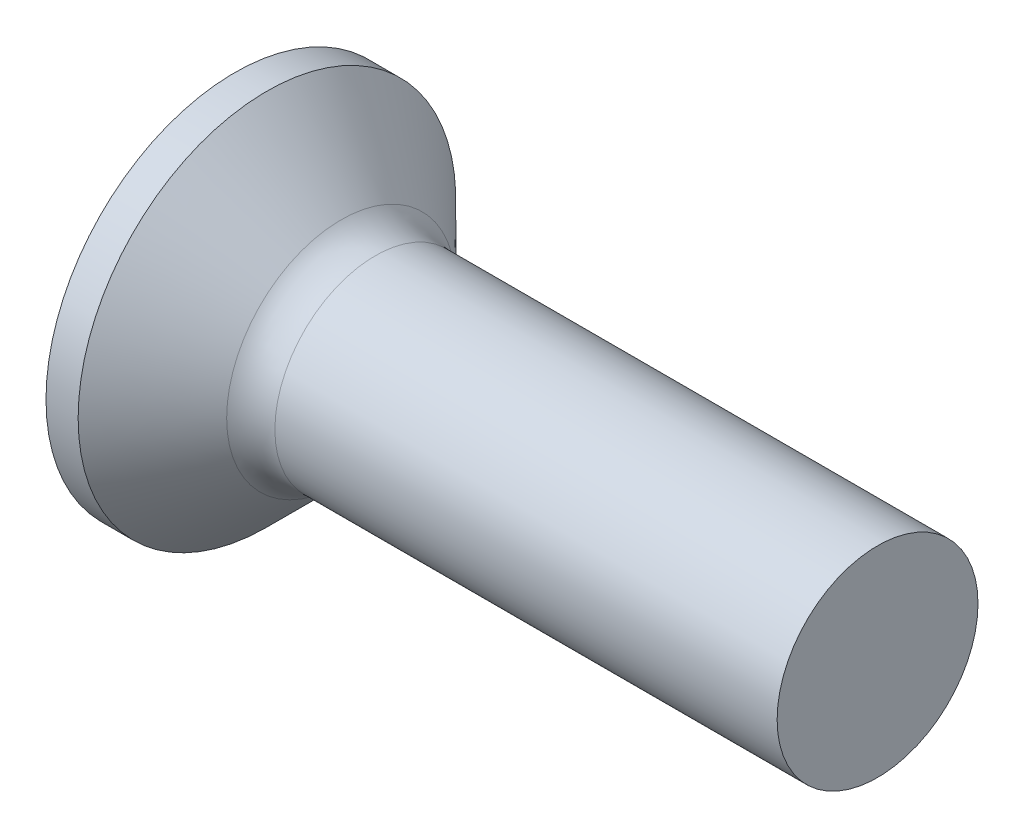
SolidWorks part; units mm, degrees
revolve "Base-Revolve" add sketch "BodySke"
sketch "BodySke" plane through (0, 0, 0) normal (0, 0, 1) x (1, 0, 0)
  line L0 (0, 0) -> (0, 2.35)
  line L1 (0, 2.35) -> (0.4, 2.35)
  line L2 (1.5, 1.25) -> (8, 1.25)
  line L3 (8, 1.25) -> (8, 0)
  line L4 (8, 0) -> (0, 0)
  line L5 (-6.35, 0) -> (82.55, 0) construction
  line L6 (1.5, -1.25) -> (8, -1.25) construction
  line L7 (0.4, -2.35) -> (1.5, -1.25) construction
  line L8 (0.4, 2.35) -> (1.5, 1.25)
  line L9 (0, -2.35) -> (0.4, -2.35) construction
  line L10 (1.95, 2.8375) -> (1.95, -6.6875) construction
  line L11 (0, 6.35) -> (0, -3.175) construction
fillet "Fillet1" radius 0.6 1 edges at (1.5, 0, 1.25)
ref_plane "Plane1" through (0, 0, 0) normal (0, 0, 1) x (1, 0, 0)
ref_plane "Plane2" through (0, 0, 0) normal (0, 1, 0) x (1, 0, 0)
ref_plane "Plane3" through (0, 0, 0) normal (1, 0, 0) x (0, 0, -1)
sketch "Sketch3" plane through (0, 0, 0) normal (-1, 0, 0) x (0, 0, 1)
  line L0 (-0.37, 1.4) -> (0.37, 1.4)
  line L1 (0.37, 1.4) -> (0.37, -1.4)
  line L2 (0.37, -1.4) -> (-0.37, -1.4)
  line L3 (-0.37, -1.4) -> (-0.37, 1.4)
ref_plane "Plane4" through (1.73, 0, 0) normal (-1, 0, 0) x (0, 0, 1)
sketch "Sketch4" plane through (1.73, 0, 0) normal (-1, 0, 0) x (0, 0, 1)
  line L0 (-0.37, 0.5375) -> (0.37, 0.5375)
  line L3 (0.37, 0.5375) -> (0.37, -0.5375)
  line L4 (0.37, -0.5375) -> (-0.37, -0.5375)
  line L5 (-0.37, -0.5375) -> (-0.37, 0.5375)
loft "Recess" cut profiles "Sketch3", "Sketch4"
pattern_circular "RecPat" count 2 every 90 about axis through (0, 0, 0) along (1, 0, 0) of "Recess"
sketch "RecCorSke" plane through (0, 0, 0) normal (0, 0, 1) x (1, 0, 0)
  line L0 (-3.175, 0) -> (15.875, 0) construction
  line L2 (0, 0) -> (0, 0.677)
  line L3 (0, 0.677) -> (1.73, 0.556)
  line L4 (1.73, 0.556) -> (1.9107, 0)
  line L5 (1.9107, 0) -> (0, 0)
revolve "RecessCore" cut sketch "RecCorSke" angle 360 about L0
sketch "ThdSchSke" plane through (0, 0, 0) normal (0, 0, 1) x (1, 0, 0)
  line L0 (1.95, -0.9965) -> (1.7725, -1.25)
  line L1 (1.95, -0.9965) -> (2.1275, -1.25)
  line L2 (2.1275, -1.25) -> (2.1275, -1.5625)
  line L3 (-3.175, 0) -> (5.1513, 0) construction
  line L5 (2.1275, -1.5625) -> (1.7725, -1.5625)
  line L6 (1.7725, -1.5625) -> (1.7725, -1.25)
  line L7 (0, 2.35) -> (0, -2.35) construction
revolve "ThreadSchematic" [suppressed] cut sketch "ThdSchSke" angle 360 about L3
pattern_linear "ThdSchPat" [suppressed]
equation "\"D1@Sketch3\" = \"Cross_dia@Sketch3\" / 2"
equation "\"D2@Sketch3\" = \"Cross_width@Sketch3\" / 2"
equation "\"Depth@RecCorSke\" = \"Cross_depth@Plane4\""
equation "\"D1@Sketch4\" = \"Cross_width@Sketch3\""
equation "\"D2@Sketch4\" = \"Cross_dia@Sketch3\" - 2.0 * \"Cross_depth@Plane4\" * tan(26.5  * 0.017453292)"
equation "\"D3@Sketch4\" = \"D1@Sketch4\" / 2"
equation "\"D4@Sketch4\" = \"D2@Sketch4\" / 2"
equation "\"Thread_length@ThreadCosmetic\" = ((sgn( (\"Length@BodySke\" - \"Advance@BodySke\" * 1.0 - \"Head_ht@BodySke\" ) - \"Thread_nom@BodySke\" )-1)*( (\"Length@BodySke\" - \"Advance@BodySke\" * 1.0 - \"Head_ht@BodySke\" "
equation "\"Thread_minor@ThdSchSke\" = \"Thread_minor@ThreadCosmetic\""
equation "\"Diameter@ThdSchSke\" = \"Diameter@BodySke\""
equation "\"Overcut@ThdSchSke\" = \"Diameter@BodySke\" * 1.25"
equation "\"Start@ThdSchSke\" = 0.000001 + \"Length@BodySke\" - \"Thread_length@ThreadCosmetic\"  '---Countersunk---"
equation "\"Num_threads@ThdSchPat\" = int( \"Thread_length@ThreadCosmetic\" / \"Advance@BodySke\" + 0.999 )  + 1"
equation "\"Advance@ThdSchPat\" = \"Thread_length@ThreadCosmetic\" /  (\"Num_threads@ThdSchPat\" - 1) 'relax it"
